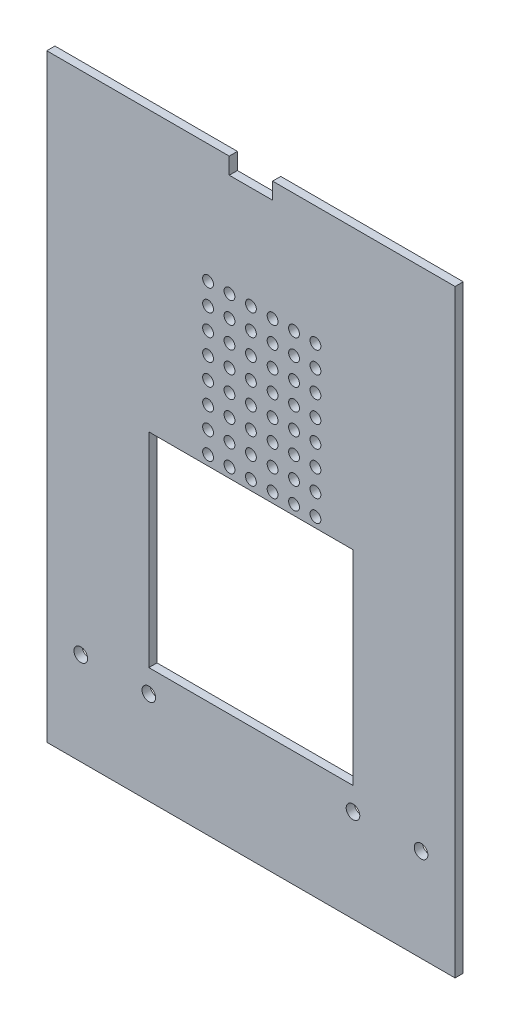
SolidWorks part; units mm, degrees
ref_plane "Front Plane" through (0, 0, 0) normal (0, 0, 1) x (1, 0, 0)
ref_plane "Top Plane" through (0, 0, 0) normal (0, 1, 0) x (1, 0, 0)
ref_plane "Right Plane" through (0, 0, 0) normal (1, 0, 0) x (0, 0, -1)
sketch "Sketch1" plane through (0, 0, 0) normal (0, 0, 1) x (1, 0, 0)
  line L1 (-76.2, 146.05) -> (76.2, 146.05)
  line L2 (-76.2, 146.05) -> (-76.2, -146.05)
  line L3 (-76.2, -146.05) -> (76.2, -146.05)
  line L4 (76.2, 146.05) -> (76.2, -146.05)
  line L5 (-76.2, 146.05) -> (76.2, -146.05) construction
  line L6 (-76.2, -146.05) -> (76.2, 146.05) construction
  point P0 (0, 0)
  dimension "D1" = 152.4
  dimension "D2" = 292.1
extrude "Boss-Extrude1" add sketch "Sketch1" along normal blind 3.048
sketch "Sketch2" plane through (0, 0, 0) normal (0, 0, 1) x (1, 0, 0)
  line L1 (-76.2, -146.05) -> (76.2, -146.05) construction
  line L2 (-76.2, -146.05) -> (76.2, -146.05) construction
  line L3 (8.0869, 109.0549) -> (-8.0869, 109.0549)
  line L4 (8.0869, 109.0549) -> (8.0869, 76.3651)
  line L5 (8.0869, 76.3651) -> (-8.0869, 76.3651)
  line L6 (-8.0869, 109.0549) -> (-8.0869, 76.3651)
  line L7 (8.0869, 109.0549) -> (-8.0869, 76.3651) construction
  line L8 (8.0869, 76.3651) -> (-8.0869, 109.0549) construction
  line L9 (-38.1, -21.59) -> (38.1, -21.59)
  line L10 (-38.1, -21.59) -> (-38.1, -97.79)
  line L11 (-38.1, -97.79) -> (38.1, -97.79)
  line L12 (38.1, -21.59) -> (38.1, -97.79)
  line L13 (-38.1, -21.59) -> (38.1, -97.79) construction
  line L14 (-38.1, -97.79) -> (38.1, -21.59) construction
  circle A1 centre (0, 92.71) radius 10.7315
  circle A2 centre (0, 38.1) radius 2.0193
  circle A3 centre (0, 30.1) radius 2.0193
  circle A4 centre (0, 22.1) radius 2.0193
  circle A5 centre (0, 14.1) radius 2.0193
  circle A6 centre (0, 6.1) radius 2.0193
  circle A7 centre (0, -1.9) radius 2.0193
  circle A8 centre (0, -9.9) radius 2.0193
  circle A9 centre (0, -17.9) radius 2.0193
  circle A10 centre (-8, 38.1) radius 2.0193
  circle A11 centre (-16, 38.1) radius 2.0193
  circle A12 centre (-8, 30.1) radius 2.0193
  circle A13 centre (-16, 30.1) radius 2.0193
  circle A14 centre (-8, 22.1) radius 2.0193
  circle A15 centre (-16, 22.1) radius 2.0193
  circle A16 centre (-8, 14.1) radius 2.0193
  circle A17 centre (-16, 14.1) radius 2.0193
  circle A18 centre (-8, 6.1) radius 2.0193
  circle A19 centre (-16, 6.1) radius 2.0193
  circle A20 centre (-8, -1.9) radius 2.0193
  circle A21 centre (-16, -1.9) radius 2.0193
  circle A22 centre (-8, -9.9) radius 2.0193
  circle A23 centre (-16, -9.9) radius 2.0193
  circle A24 centre (-8, -17.9) radius 2.0193
  circle A25 centre (-16, -17.9) radius 2.0193
  circle A26 centre (24.0869, 14.1) radius 2.0193
  circle A27 centre (8.0869, 14.1) radius 2.0193
  circle A28 centre (8.0869, -17.9) radius 2.0193
  circle A29 centre (24.0869, 6.1) radius 2.0193
  circle A30 centre (16.0869, 6.1) radius 2.0193
  circle A31 centre (8.0869, -1.9) radius 2.0193
  circle A32 centre (8.0869, 30.1) radius 2.0193
  circle A33 centre (24.0869, 22.1) radius 2.0193
  circle A34 centre (24.0869, -1.9) radius 2.0193
  circle A35 centre (24.0869, -9.9) radius 2.0193
  circle A36 centre (8.0869, 6.1) radius 2.0193
  circle A37 centre (16.0869, 22.1) radius 2.0193
  circle A38 centre (8.0869, 22.1) radius 2.0193
  circle A39 centre (8.0869, -9.9) radius 2.0193
  circle A40 centre (24.0869, -17.9) radius 2.0193
  circle A41 centre (16.0869, 14.1) radius 2.0193
  circle A42 centre (16.0869, -17.9) radius 2.0193
  circle A43 centre (16.0869, 30.1) radius 2.0193
  circle A44 centre (24.0869, 30.1) radius 2.0193
  circle A45 centre (16.0869, -9.9) radius 2.0193
  circle A46 centre (16.0869, -1.9) radius 2.0193
  circle A47 centre (16.0869, 38.1) radius 2.0193
  circle A48 centre (8.0869, 38.1) radius 2.0193
  circle A49 centre (24.0869, 38.1) radius 2.0193
  point P2 (0, -59.69)
  point P111 (0, 0)
  point P112 (0, 0)
  point P113 (0, 0)
  point P114 (0, 0)
  point P115 (0, 0)
  point P116 (0, 0)
  point P117 (0, 0)
  point P118 (0, 0)
  point P119 (0, 0)
  dimension "D3" = 21.463
  dimension "D5" = 4.0386
  dimension "D7" = 184.15
  dimension "D2" = 86.36
  dimension "D4" = 152.4
  dimension "D8" = 16.1738
  dimension "D9" = 32.6898
  dimension "D11" = 76.2
  dimension "D12" = 76.2
  dimension "D6" = 3
  dimension "D10" = 8
extrude "Cut-Extrude1" cut sketch "Sketch2" along normal through all contours A13 | A19 | A18 | A20 | A24 | A39 | A31
sketch "Sketch4" plane through (0, 0, 0) normal (0, 0, 1) x (1, 0, 0)
  line L1 (76.2, 146.05) -> (-76.2, 146.05)
  line L2 (76.2, 146.05) -> (76.2, 82.55)
  line L3 (76.2, 82.55) -> (-76.2, 82.55)
  line L4 (-76.2, 146.05) -> (-76.2, 82.55)
  point P5 (20.32, 146.05)
  dimension "D1" = 152.4
  dimension "D2" = 63.5
extrude "Cut-Extrude2" cut sketch "Sketch4" along normal through all
sketch "Sketch5" plane through (0, 0, 0) normal (0, 0, -1) x (-1, 0, 0)
  line L0 (76.2, -146.05) -> (-76.2, -146.05) construction
  line L1 (-76.2, -146.05) -> (-76.2, 82.55) construction
  line L2 (0, 1.6764) -> (0, -1.6764) construction
  circle A0 centre (-38.1, -106.299) radius 2.54
  circle A2 centre (-63.5, -106.299) radius 2.54
  circle A3 centre (63.5, -106.299) radius 2.54
  circle A4 centre (38.1, -106.299) radius 2.54
  dimension "D1" = 5.08
  dimension "D2" = 39.751
  dimension "D3" = 25.4
  dimension "D4" = 12.7
extrude "Cut-Extrude3" cut sketch "Sketch5" against normal through all
sketch "Sketch6" plane through (0, 0, 0) normal (0, 0, -1) x (-1, 0, 0)
  line L0 (76.2, 82.55) -> (76.2, -146.05) construction
  line L1 (-76.2, -146.05) -> (76.2, -146.05)
  line L2 (-76.2, -146.05) -> (-76.2, -140.97)
  line L3 (-76.2, -140.97) -> (76.2, -140.97)
  line L4 (76.2, -146.05) -> (76.2, -140.97)
  dimension "D1" = 5.08
extrude "Cut-Extrude4" cut sketch "Sketch6" against normal through all
equation "\"thickness_acrylic0.1\"=0.1in"
equation "\"motor offset\"=6mm"
equation "\"thickness0.25\"=0.225in"
equation "\"thickness0.125\"=0.122in"
